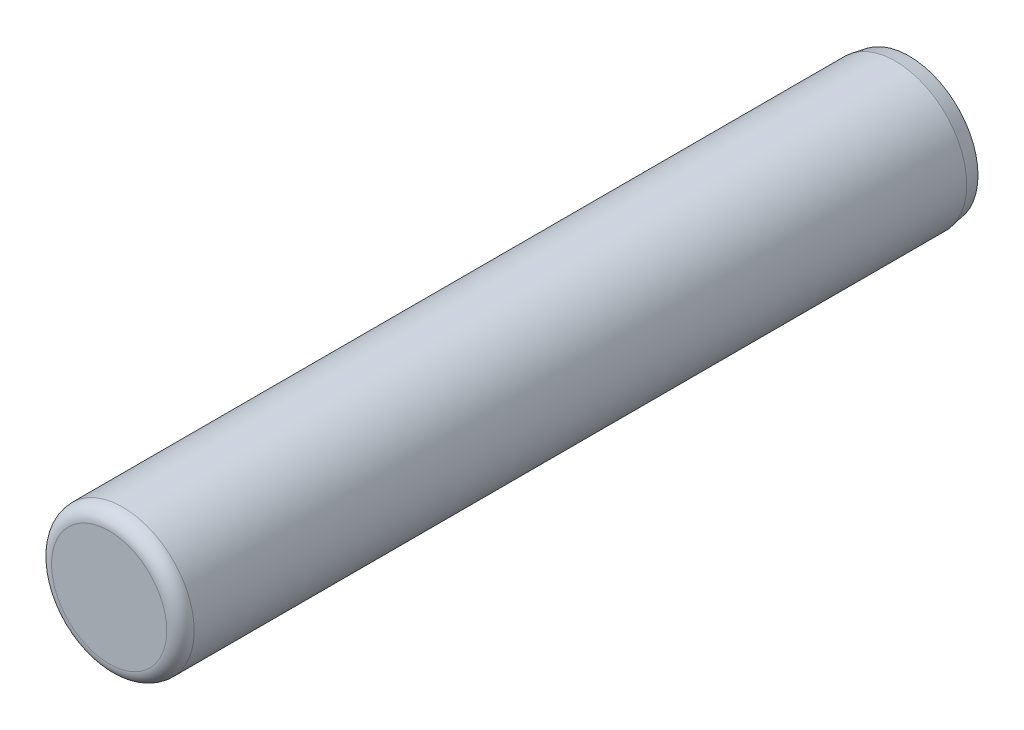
SolidWorks part; units mm, degrees
ref_plane "Front Plane" through (0, 0, 0) normal (0, 0, 1) x (1, 0, 0)
ref_plane "Top Plane" through (0, 0, 0) normal (0, 1, 0) x (1, 0, 0)
ref_plane "Right Plane" through (0, 0, 0) normal (1, 0, 0) x (0, 0, -1)
sketch "Sketch1" plane through (0, 0, 0) normal (0, 0, 1) x (1, 0, 0)
  circle A0 centre (0, 0) radius 1.9812
extrude "Boss-Extrude1" add sketch "Sketch1" along normal blind 22.225
fillet "Fillet1" radius 0.381 1 edges at (1.9812, 0, 22.225)
chamfer "Chamfer1" distance 0.381 angle 10 1 edges at (1.9812, 0, 0)
